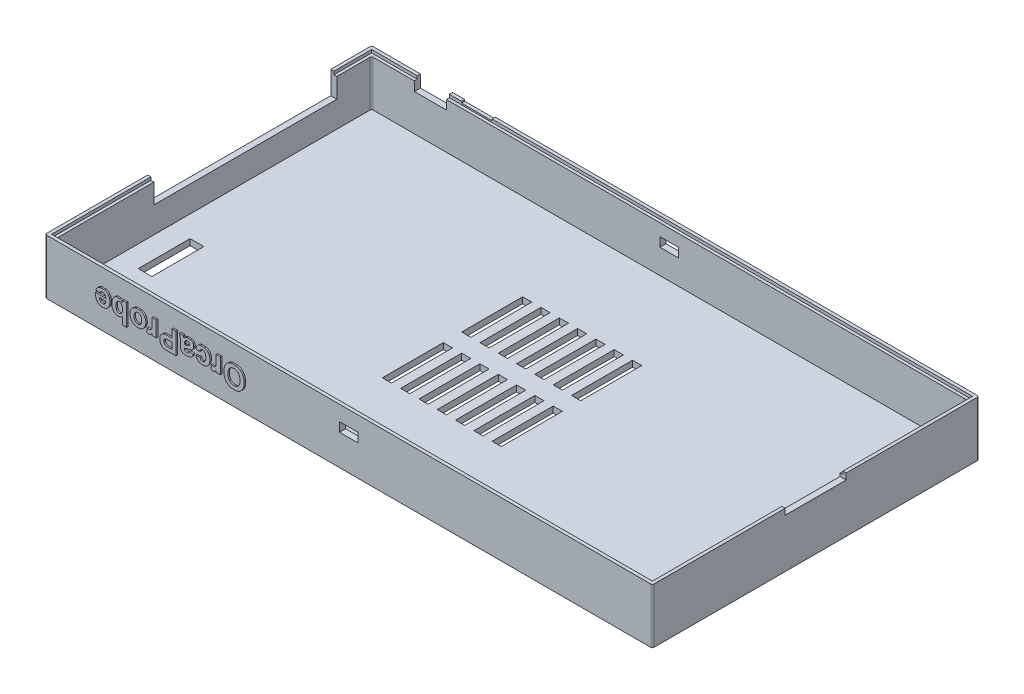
SolidWorks part; units mm, degrees
ref_plane "Front Plane" through (0, 0, 0) normal (0, 0, 1) x (1, 0, 0)
ref_plane "Top Plane" through (0, 0, 0) normal (0, 1, 0) x (1, 0, 0)
ref_plane "Right Plane" through (0, 0, 0) normal (1, 0, 0) x (0, 0, -1)
sketch "Sketch1" plane through (0, 0, 0) normal (0, 1, 0) x (1, 0, 0)
  line L1 (-97.5, 51.5) -> (97.5, 51.5)
  line L2 (-97.5, 51.5) -> (-97.5, -51.5)
  line L3 (-97.5, -51.5) -> (97.5, -51.5)
  line L4 (97.5, 51.5) -> (97.5, -51.5)
  line L5 (-97.5, 51.5) -> (97.5, -51.5) construction
  line L6 (-97.5, -51.5) -> (97.5, 51.5) construction
  point P0 (0, 0)
  dimension "D1" = 103
  dimension "D2" = 195
extrude "Boss-Extrude1" add sketch "Sketch1" along normal blind 2
sketch "Sketch2" plane through (0, 0, 0) normal (0, -1, 0) x (1, 0, 0)
  line L0 (99.5, -53.5) -> (99.5, 53.5)
  line L1 (99.5, 53.5) -> (-99.5, 53.5)
  line L2 (-99.5, 53.5) -> (-99.5, -53.5)
  line L3 (-99.5, -53.5) -> (99.5, -53.5)
  line L4 (97.5, -51.5) -> (97.5, 51.5)
  line L5 (97.5, 51.5) -> (-97.5, 51.5)
  line L6 (-97.5, 51.5) -> (-97.5, -51.5)
  line L7 (-97.5, -51.5) -> (97.5, -51.5)
  line L8 (97.5, -51.5) -> (97.5, 51.5)
  line L9 (97.5, 51.5) -> (-97.5, 51.5)
  line L10 (-97.5, 51.5) -> (-97.5, -51.5)
  line L11 (-97.5, -51.5) -> (97.5, -51.5)
  dimension "D1" = 0
  dimension "D2" = 2
extrude "Boss-Extrude2" add sketch "Sketch2" against normal blind 18
sketch "Sketch5" plane through (0, 18, 0) normal (0, 1, 0) x (1, 0, 0)
  line L0 (99.5, 53.5) -> (-99.5, 53.5) construction
  line L1 (-99.5, 53.5) -> (-99.5, -53.5) construction
  line L2 (-99.5, -53.5) -> (99.5, -53.5) construction
  line L3 (99.5, -53.5) -> (99.5, 53.5) construction
  line L4 (97.5, -51.5) -> (97.5, 51.5) construction
  line L5 (97.5, 51.5) -> (-97.5, 51.5) construction
  line L6 (-97.5, 51.5) -> (-97.5, -51.5) construction
  line L7 (-97.5, -51.5) -> (97.5, -51.5) construction
  line L8 (99.5, 53.5) -> (-99.5, 53.5)
  line L9 (-99.5, 53.5) -> (-99.5, -53.5)
  line L10 (-99.5, -53.5) -> (99.5, -53.5)
  line L11 (99.5, -53.5) -> (99.5, 53.5)
  line L12 (97.5, -51.5) -> (97.5, 51.5)
  line L13 (97.5, 51.5) -> (-97.5, 51.5)
  line L14 (-97.5, 51.5) -> (-97.5, -51.5)
  line L15 (-97.5, -51.5) -> (97.5, -51.5)
  line L16 (98.45, 52.45) -> (-98.45, 52.45)
  line L17 (-98.45, 52.45) -> (-98.45, -52.45)
  line L18 (-98.45, -52.45) -> (98.45, -52.45)
  line L19 (98.45, -52.45) -> (98.45, 52.45)
  dimension "D1" = 0.95
extrude "Cut-Extrude2" cut sketch "Sketch5" against normal blind 1 contours L18 L19 L16 L17 M8 M5 M6 M7
sketch "Sketch7" plane through (0, 0, -51.5) normal (0, 0, 1) x (1, 0, 0)
  line L0 (0, 17) -> (0, 2) construction
  line L2 (-3.05, 13.05) -> (3.05, 13.05)
  line L3 (-3.05, 13.05) -> (-3.05, 10.05)
  line L4 (97.5, 17) -> (-97.5, 17)
  line L5 (-97.5, 17) -> (-97.5, 2)
  line L6 (-97.5, 2) -> (97.5, 2)
  line L7 (97.5, 2) -> (97.5, 17)
  line L8 (97.5, 17) -> (-97.5, 17)
  line L9 (-97.5, 17) -> (-97.5, 2)
  line L10 (-97.5, 2) -> (97.5, 2)
  line L11 (97.5, 2) -> (97.5, 17)
  line L12 (-3.05, 10.05) -> (3.05, 10.05)
  line L13 (3.05, 13.05) -> (3.05, 10.05)
  line L14 (-3.05, 13.05) -> (3.05, 10.05) construction
  line L15 (-3.05, 10.05) -> (3.05, 13.05) construction
  point P6 (0, 11.55)
  dimension "D2" = 3.95
  dimension "D3" = 6.1
  dimension "D4" = 3
  dimension "D1" = 0
extrude "Cut-Extrude3" cut sketch "Sketch7" against normal through all both and the other way through all contours L3 L2 L13 L12
sketch "Sketch8" plane through (0, 0, 53.5) normal (0, 0, 1) x (1, 0, 0)
  line L0 (-33.3286, 12.4183) -> (-84.1269, 12.4183) construction
  line L1 (-42.9312, 12.4183) -> (-41.585, 12.4183)
  line L2 (-41.585, 12.4183) -> (-41.585, 7.303)
  line L3 (-41.585, 7.303) -> (-42.9312, 7.303)
  line L4 (-99.5, 0) -> (99.5, 0)
  line L5 (99.5, 0) -> (99.5, 18)
  line L6 (99.5, 18) -> (-99.5, 18)
  line L7 (-99.5, 18) -> (-99.5, 0)
  line L8 (-99.5, 0) -> (99.5, 0)
  line L9 (99.5, 0) -> (99.5, 18)
  line L10 (99.5, 18) -> (-99.5, 18)
  line L11 (-99.5, 18) -> (-99.5, 0)
  line L12 (-42.9312, 7.303) -> (-42.9312, 8.0167)
  line L13 (-44.7261, 7.4965) -> (-44.412, 8.7767)
  line L14 (-42.9312, 10.9011) -> (-42.9312, 12.4183)
  line L15 (-49.5722, 8.8286) -> (-48.2261, 9.0081)
  line L16 (-48.3158, 10.5337) -> (-49.662, 10.7132)
  line L17 (-51.6363, 8.8286) -> (-50.4697, 8.6491)
  line L18 (-54.6876, 9.1736) -> (-54.6876, 10.7455)
  line L19 (-55.0466, 12.4183) -> (-53.7004, 12.4183)
  line L20 (-53.3415, 9.0081) -> (-53.3415, 8.8805)
  line L21 (-53.3415, 10.2491) -> (-53.3415, 9.9953)
  line L22 (-56.1235, 12.4183) -> (-56.1235, 5.4183)
  line L23 (-56.1235, 5.4183) -> (-58.3629, 5.4183)
  line L24 (-58.3909, 9.8158) -> (-57.4697, 9.8158)
  line L25 (-57.4697, 9.8158) -> (-57.4697, 12.4183)
  line L26 (-57.4697, 12.4183) -> (-56.1235, 12.4183)
  line L27 (-57.4697, 6.585) -> (-57.4697, 8.6491)
  line L28 (-57.4697, 8.6491) -> (-58.2774, 8.6491)
  line L29 (-58.182, 6.585) -> (-57.4697, 6.585)
  line L30 (-63.9312, 12.4183) -> (-62.585, 12.4183)
  line L31 (-62.585, 12.4183) -> (-62.585, 7.303)
  line L32 (-62.585, 7.303) -> (-63.9312, 7.303)
  line L33 (-63.9312, 7.303) -> (-63.9312, 8.0167)
  line L34 (-65.7261, 7.4965) -> (-65.412, 8.7767)
  line L35 (-63.9312, 10.9011) -> (-63.9312, 12.4183)
  line L36 (-72.2774, 12.4183) -> (-72.2774, 5.4183)
  line L37 (-72.2774, 5.4183) -> (-73.6235, 5.4183)
  line L38 (-73.6235, 5.4183) -> (-73.6235, 7.9129)
  line L39 (-73.6235, 11.6794) -> (-73.6235, 12.4183)
  line L40 (-73.6235, 12.4183) -> (-72.2774, 12.4183)
  line L41 (-81.0722, 10.803) -> (-82.4184, 10.9825)
  line L42 (-82.5081, 10.2645) -> (-79.0979, 10.2645)
  line L43 (-79.1217, 9.4568) -> (-81.162, 9.4568)
  spline S0 degree 3 poles (-33.7774, 8.9604) (-33.7753, 8.7905) (-33.7874, 8.5409) (-33.8179, 8.2159) (-33.8541, 7.9883) (-33.8967, 7.7709) (-33.9662, 7.4994) (-34.0373, 7.3054) (-34.0901, 7.181) knots 0 0 0 0 0.280099 0.411798 0.538154 0.660002 0.777042 1 1 1 1
  spline S1 degree 3 poles (-34.0901, 7.181) (-34.1666, 7.0052) (-34.3063, 6.7521) (-34.5342, 6.4421) (-34.724, 6.2257) (-34.9288, 6.0295) (-35.2158, 5.8058) (-35.4496, 5.6712) (-35.6129, 5.6034) knots 0 0 0 0 0.256308 0.385121 0.514056 0.640986 0.763938 1 1 1 1
  spline S2 degree 3 poles (-35.6129, 5.6034) (-35.7213, 5.5572) (-35.889, 5.4951) (-36.1215, 5.4354) (-36.3026, 5.3948) (-36.4907, 5.3668) (-36.7524, 5.335) (-36.9529, 5.3293) (-37.0881, 5.3286) knots 0 0 0 0 0.23411 0.354106 0.476628 0.602521 0.731466 1 1 1 1
  spline S3 degree 3 poles (-37.0881, 5.3286) (-37.3287, 5.3304) (-37.6833, 5.3544) (-38.1366, 5.455) (-38.4495, 5.5614) (-38.745, 5.6944) (-39.0209, 5.8594) (-39.2777, 6.0546) (-39.5146, 6.2774) (-39.7285, 6.5266) (-39.9121, 6.8026) (-40.0709, 7.0997) (-40.1976, 7.4215) (-40.298, 7.7654) (-40.3915, 8.2682) (-40.4201, 8.6602) (-40.4184, 8.9282) knots 0 0 0 0 0.130227 0.191372 0.250609 0.308646 0.36635 0.42409 0.482748 0.54192 0.601306 0.661694 0.723753 0.787994 0.855173 1 1 1 1
  spline S4 degree 3 poles (-40.4184, 8.9282) (-40.4186, 9.194) (-40.3936, 9.5836) (-40.2991, 10.083) (-40.199, 10.4244) (-40.0734, 10.7443) (-39.9163, 11.0396) (-39.7342, 11.3144) (-39.5211, 11.5621) (-39.2867, 11.7851) (-39.0305, 11.9781) (-38.7575, 12.144) (-38.4634, 12.2774) (-38.1507, 12.381) (-37.6998, 12.4826) (-37.3468, 12.5063) (-37.1077, 12.5081) knots 0 0 0 0 0.144611 0.211674 0.276037 0.337883 0.398273 0.457645 0.516795 0.575603 0.633316 0.690913 0.749049 0.808543 0.869789 1 1 1 1
  spline S5 degree 3 poles (-37.1077, 12.5081) (-36.8654, 12.5058) (-36.5079, 12.4834) (-36.0524, 12.3805) (-35.7366, 12.2796) (-35.4414, 12.1445) (-35.1652, 11.9821) (-34.9096, 11.7877) (-34.6746, 11.5664) (-34.4616, 11.32) (-34.2798, 11.047) (-34.1223, 10.7543) (-33.997, 10.4375) (-33.8966, 10.0999) (-33.8024, 9.607) (-33.777, 9.2226) (-33.7774, 8.9604) knots 0 0 0 0 0.13222 0.194074 0.254079 0.312551 0.370559 0.428376 0.487115 0.546179 0.605446 0.665495 0.726979 0.790725 0.857159 1 1 1 1
  spline S6 degree 3 poles (-35.1235, 8.9141) (-35.1224, 9.1016) (-35.1391, 9.375) (-35.1973, 9.7251) (-35.2593, 9.9614) (-35.3371, 10.1804) (-35.4345, 10.3804) (-35.548, 10.5633) (-35.6807, 10.7255) (-35.8254, 10.8701) (-35.9793, 10.9971) (-36.1442, 11.1034) (-36.3181, 11.1906) (-36.5018, 11.2577) (-36.7621, 11.326) (-36.9671, 11.3397) (-37.1049, 11.3414) knots 0 0 0 0 0.159025 0.231845 0.300713 0.366067 0.428673 0.489076 0.548283 0.606046 0.662406 0.717184 0.77216 0.827113 0.882801 1 1 1 1
  spline S7 degree 3 poles (-37.1049, 11.3414) (-37.2428, 11.3403) (-37.4472, 11.3248) (-37.7081, 11.2594) (-37.891, 11.1926) (-38.0633, 11.104) (-38.2272, 10.9989) (-38.38, 10.8728) (-38.524, 10.7301) (-38.6531, 10.5669) (-38.7659, 10.3843) (-38.8618, 10.1827) (-38.9374, 9.9611) (-39.0005, 9.722) (-39.0554, 9.3649) (-39.074, 9.0863) (-39.0722, 8.8945) knots 0 0 0 0 0.116778 0.172169 0.226925 0.280998 0.335578 0.39118 0.448177 0.506677 0.566655 0.629221 0.694952 0.764337 0.838 1 1 1 1
  spline S8 degree 3 poles (-39.0722, 8.8945) (-39.0721, 8.7053) (-39.0583, 8.4299) (-39.0007, 8.0783) (-38.9425, 7.842) (-38.8666, 7.6252) (-38.7757, 7.4266) (-38.6661, 7.2476) (-38.5393, 7.0884) (-38.3982, 6.9492) (-38.2462, 6.8282) (-38.0835, 6.7244) (-37.9093, 6.6403) (-37.7234, 6.5753) (-37.4561, 6.5131) (-37.2467, 6.4955) (-37.1049, 6.4953) knots 0 0 0 0 0.161222 0.234273 0.303223 0.3682 0.429658 0.489001 0.54652 0.602548 0.657517 0.711752 0.766601 0.821882 0.879153 1 1 1 1
  spline S9 degree 3 poles (-37.1049, 6.4953) (-36.963, 6.4955) (-36.7537, 6.5132) (-36.4857, 6.5753) (-36.2993, 6.6414) (-36.125, 6.7278) (-35.9604, 6.8308) (-35.807, 6.9535) (-35.6653, 7.0954) (-35.5366, 7.2559) (-35.4255, 7.437) (-35.332, 7.6372) (-35.2542, 7.8558) (-35.197, 8.0939) (-35.136, 8.4469) (-35.1245, 8.7242) (-35.1235, 8.9141) knots 0 0 0 0 0.120039 0.176926 0.232342 0.286997 0.341204 0.396361 0.452852 0.510542 0.570032 0.63213 0.697177 0.76605 0.839067 1 1 1 1
  spline S10 degree 3 poles (-42.9312, 8.0167) (-42.9765, 7.9393) (-43.0398, 7.8266) (-43.1319, 7.6894) (-43.1967, 7.6021) (-43.2587, 7.5252) (-43.32, 7.46) (-43.3778, 7.4045) (-43.4551, 7.349) (-43.5535, 7.2946) (-43.7218, 7.2314) (-43.857, 7.2134) (-43.9478, 7.2132) knots 0 0 0 0 0.196067 0.282205 0.361076 0.433675 0.498005 0.556559 0.608461 0.705408 0.801424 1 1 1 1
  spline S11 degree 3 poles (-43.9478, 7.2132) (-44.083, 7.2132) (-44.3634, 7.2658) (-44.6096, 7.4092) (-44.7261, 7.4965) knots 0 0 0 0 0.480615 1 1 1 1
  spline S12 degree 3 poles (-44.412, 8.7767) (-44.3132, 8.7106) (-44.1183, 8.6057) (-43.9013, 8.5597) (-43.8006, 8.5594) knots 0 0 0 0 0.542857 1 1 1 1
  spline S13 degree 3 poles (-43.8006, 8.5594) (-43.7158, 8.5595) (-43.5903, 8.577) (-43.4372, 8.64) (-43.3347, 8.7077) (-43.242, 8.8007) (-43.1627, 8.9245) (-43.0936, 9.0773) (-43.0447, 9.2272) (-43.0124, 9.3724) (-42.9908, 9.5116) (-42.9711, 9.6775) (-42.9564, 9.8703) (-42.9456, 10.0901) (-42.9341, 10.4364) (-42.9304, 10.7099) (-42.9312, 10.9011) knots 0 0 0 0 0.091623 0.134828 0.177797 0.223473 0.27554 0.335599 0.404062 0.445443 0.496051 0.556017 0.62588 0.704708 0.793577 1 1 1 1
  spline S14 degree 3 poles (-48.2261, 9.0081) (-48.2048, 8.8883) (-48.163, 8.7139) (-48.0482, 8.5173) (-47.9474, 8.4001) (-47.8256, 8.3115) (-47.6378, 8.2201) (-47.4769, 8.201) (-47.3693, 8.2004) knots 0 0 0 0 0.282192 0.405789 0.521816 0.635786 0.750455 1 1 1 1
  spline S15 degree 3 poles (-47.3693, 8.2004) (-47.2947, 8.201) (-47.1836, 8.2092) (-47.0442, 8.2506) (-46.9459, 8.2892) (-46.8553, 8.3419) (-46.7694, 8.4041) (-46.6911, 8.4793) (-46.6177, 8.5652) (-46.5502, 8.6644) (-46.4955, 8.7804) (-46.4472, 8.9107) (-46.409, 9.0564) (-46.3783, 9.2171) (-46.3471, 9.4609) (-46.3421, 9.6526) (-46.3415, 9.7849) knots 0 0 0 0 0.105025 0.154878 0.203749 0.252836 0.301667 0.352271 0.404877 0.460213 0.520091 0.584461 0.655147 0.731346 0.814052 1 1 1 1
  spline S16 degree 3 poles (-46.3415, 9.7849) (-46.3407, 9.9319) (-46.349, 10.1443) (-46.3797, 10.4148) (-46.4095, 10.5922) (-46.4505, 10.7515) (-46.4988, 10.8942) (-46.5572, 11.0196) (-46.6257, 11.1276) (-46.7005, 11.2212) (-46.7821, 11.3015) (-46.8695, 11.3696) (-46.9634, 11.4248) (-47.0631, 11.4685) (-47.2074, 11.5107) (-47.3216, 11.5213) (-47.3988, 11.5209) knots 0 0 0 0 0.192168 0.2777 0.355889 0.427205 0.492549 0.552708 0.607657 0.659402 0.709113 0.757045 0.803908 0.851267 0.899047 1 1 1 1
  spline S17 degree 3 poles (-47.3988, 11.5209) (-47.5102, 11.522) (-47.6747, 11.4953) (-47.8706, 11.4009) (-47.9746, 11.318) (-48.0473, 11.2369) (-48.1001, 11.167) (-48.1447, 11.0846) (-48.1898, 10.9948) (-48.226, 10.893) (-48.2758, 10.7405) (-48.2988, 10.6176) (-48.3158, 10.5337) knots 0 0 0 0 0.224156 0.328867 0.434599 0.489185 0.547672 0.610419 0.677286 0.749591 0.827505 1 1 1 1
  spline S18 degree 3 poles (-49.662, 10.7132) (-49.6296, 10.8544) (-49.5704, 11.0593) (-49.4636, 11.317) (-49.3725, 11.4917) (-49.271, 11.6536) (-49.1574, 11.8011) (-49.0316, 11.9349) (-48.8954, 12.0566) (-48.7459, 12.163) (-48.5854, 12.2568) (-48.4116, 12.3328) (-48.2274, 12.3986) (-48.0298, 12.4463) (-47.7446, 12.4971) (-47.5219, 12.5074) (-47.3707, 12.5081) knots 0 0 0 0 0.136031 0.199773 0.261611 0.32079 0.378994 0.436129 0.493026 0.550273 0.608089 0.667225 0.728164 0.791502 0.857887 1 1 1 1
  spline S19 degree 3 poles (-47.3707, 12.5081) (-47.1985, 12.5074) (-46.9445, 12.489) (-46.6199, 12.4145) (-46.3952, 12.3375) (-46.1841, 12.2389) (-45.9878, 12.1171) (-45.805, 11.9734) (-45.6365, 11.8091) (-45.4849, 11.6257) (-45.354, 11.4235) (-45.243, 11.2048) (-45.1514, 10.9696) (-45.0817, 10.7167) (-45.0136, 10.3484) (-44.9944, 10.0609) (-44.9953, 9.8649) knots 0 0 0 0 0.128618 0.18913 0.248159 0.305594 0.362622 0.420272 0.478745 0.53798 0.597494 0.658191 0.720713 0.785555 0.853709 1 1 1 1
  spline S20 degree 3 poles (-44.9953, 9.8649) (-44.9944, 9.667) (-45.0134, 9.3771) (-45.0816, 9.0059) (-45.1518, 8.752) (-45.2413, 8.5148) (-45.3524, 8.2954) (-45.4835, 8.0928) (-45.6352, 7.9095) (-45.8033, 7.7451) (-45.9866, 7.6024) (-46.1846, 7.4826) (-46.3962, 7.3841) (-46.6221, 7.3063) (-46.9498, 7.2326) (-47.2064, 7.2138) (-47.3805, 7.2132) knots 0 0 0 0 0.146966 0.215132 0.279994 0.342413 0.403126 0.462352 0.521299 0.579489 0.636646 0.693512 0.750984 0.809727 0.870622 1 1 1 1
  spline S21 degree 3 poles (-47.3805, 7.2132) (-47.5231, 7.2113) (-47.7316, 7.2253) (-48.0004, 7.2661) (-48.1855, 7.31) (-48.3594, 7.3653) (-48.5213, 7.4348) (-48.6729, 7.5143) (-48.8122, 7.6089) (-48.9405, 7.7168) (-49.0607, 7.8361) (-49.1698, 7.9701) (-49.2698, 8.1164) (-49.3592, 8.276) (-49.4711, 8.51) (-49.534, 8.6989) (-49.5722, 8.8286) knots 0 0 0 0 0.143786 0.21066 0.274183 0.335664 0.394651 0.451859 0.508267 0.564214 0.620937 0.67894 0.73836 0.799641 0.863384 1 1 1 1
  spline S22 degree 3 poles (-50.4697, 8.6491) (-50.5026, 8.5332) (-50.5574, 8.364) (-50.6577, 8.155) (-50.7388, 8.0124) (-50.83, 7.882) (-50.9298, 7.7635) (-51.0387, 7.6573) (-51.1574, 7.5626) (-51.288, 7.4785) (-51.4335, 7.4072) (-51.5938, 7.3471) (-51.7686, 7.2989) (-51.9575, 7.2586) (-52.2392, 7.2243) (-52.4586, 7.2124) (-52.6095, 7.2132) knots 0 0 0 0 0.12811 0.188034 0.245824 0.302124 0.356698 0.410033 0.463348 0.517578 0.574607 0.635063 0.698994 0.76692 0.839974 1 1 1 1
  spline S23 degree 3 poles (-52.6095, 7.2132) (-52.7462, 7.2104) (-52.944, 7.2215) (-53.1981, 7.2399) (-53.3676, 7.2654) (-53.5242, 7.2925) (-53.6658, 7.332) (-53.795, 7.3721) (-53.9429, 7.4396) (-54.1065, 7.5326) (-54.275, 7.6616) (-54.4126, 7.8052) (-54.5036, 7.9397) (-54.5579, 8.0624) (-54.5919, 8.1713) (-54.6234, 8.296) (-54.6456, 8.4388) (-54.6661, 8.5982) (-54.6816, 8.8452) (-54.6884, 9.0388) (-54.6876, 9.1736) knots 0 0 0 0 0.121261 0.175808 0.226098 0.27338 0.31676 0.356518 0.393298 0.46077 0.523183 0.581002 0.636703 0.666236 0.699828 0.737868 0.780366 0.828024 0.880439 1 1 1 1
  spline S24 degree 3 poles (-54.6876, 10.7455) (-54.6896, 10.8501) (-54.6871, 11.0018) (-54.6992, 11.196) (-54.7042, 11.3253) (-54.7167, 11.4434) (-54.7283, 11.5507) (-54.7438, 11.6471) (-54.7683, 11.7623) (-54.8085, 11.9016) (-54.8941, 12.1337) (-54.9827, 12.3035) (-55.0466, 12.4183) knots 0 0 0 0 0.180907 0.261761 0.336164 0.404304 0.466908 0.522535 0.572901 0.670292 0.772747 1 1 1 1
  spline S25 degree 3 poles (-53.7004, 12.4183) (-53.6781, 12.3595) (-53.6363, 12.2162) (-53.5946, 12.0729) (-53.5728, 11.9893) knots 0 0 0 0 0.42099 1 1 1 1
  spline S26 degree 3 poles (-53.5728, 11.9893) (-53.5658, 11.953) (-53.5452, 11.8977) (-53.5333, 11.84) (-53.5252, 11.8196) knots 0 0 0 0 0.627226 1 1 1 1
  spline S27 degree 3 poles (-53.5252, 11.8196) (-53.4154, 11.9287) (-53.2431, 12.0808) (-52.9888, 12.2405) (-52.7968, 12.3387) (-52.5982, 12.4152) (-52.322, 12.4863) (-52.108, 12.508) (-51.9645, 12.5081) knots 0 0 0 0 0.265204 0.391032 0.513017 0.63379 0.754465 1 1 1 1
  spline S28 degree 3 poles (-51.9645, 12.5081) (-51.8414, 12.5062) (-51.6598, 12.4985) (-51.4292, 12.4486) (-51.2691, 12.4038) (-51.1206, 12.3414) (-50.9817, 12.2667) (-50.8533, 12.1783) (-50.7376, 12.0753) (-50.6325, 11.9639) (-50.5409, 11.8441) (-50.4628, 11.717) (-50.4002, 11.5821) (-50.3502, 11.4404) (-50.3034, 11.2388) (-50.2899, 11.0816) (-50.2902, 10.9754) knots 0 0 0 0 0.144841 0.212128 0.276749 0.339751 0.40091 0.461666 0.522344 0.582539 0.641279 0.699178 0.757379 0.815538 0.875322 1 1 1 1
  spline S29 degree 3 poles (-50.2902, 10.9754) (-50.2915, 10.8362) (-50.3113, 10.6283) (-50.3981, 10.3689) (-50.4846, 10.1902) (-50.5944, 10.0284) (-50.7247, 9.8847) (-50.8764, 9.7621) (-51.0511, 9.6571) (-51.2559, 9.5694) (-51.5972, 9.451) (-51.8793, 9.3868) (-52.0794, 9.3446) knots 0 0 0 0 0.156294 0.231277 0.305251 0.377986 0.449497 0.521682 0.595651 0.676965 0.770661 1 1 1 1
  spline S30 degree 3 poles (-52.0794, 9.3446) (-52.2198, 9.3157) (-52.4221, 9.2757) (-52.678, 9.2146) (-52.8447, 9.1728) (-52.9937, 9.1308) (-53.1593, 9.0808) (-53.2725, 9.0376) (-53.3415, 9.0081) knots 0 0 0 0 0.32859 0.472888 0.603397 0.722514 0.827959 1 1 1 1
  spline S31 degree 3 poles (-53.3415, 8.8805) (-53.3408, 8.7753) (-53.3276, 8.6216) (-53.2459, 8.4478) (-53.1776, 8.3658) (-53.109, 8.3174) (-53.0481, 8.2846) (-52.9766, 8.2589) (-52.8953, 8.2379) (-52.8043, 8.2216) (-52.6634, 8.2036) (-52.552, 8.2015) (-52.4749, 8.2004) knots 0 0 0 0 0.247438 0.350285 0.443787 0.492182 0.545326 0.604638 0.668872 0.740907 0.819984 1 1 1 1
  spline S32 degree 3 poles (-52.4749, 8.2004) (-52.3734, 8.2004) (-52.2268, 8.2127) (-52.0511, 8.2745) (-51.9415, 8.3357) (-51.8474, 8.4224) (-51.7323, 8.5817) (-51.671, 8.7253) (-51.6363, 8.8286) knots 0 0 0 0 0.267293 0.38058 0.486623 0.594299 0.713526 1 1 1 1
  spline S33 degree 3 poles (-53.3415, 9.9953) (-53.2377, 10.0283) (-53.0639, 10.0775) (-52.8067, 10.1389) (-52.6128, 10.1816) (-52.4503, 10.217) (-52.3356, 10.2447) (-52.2324, 10.2731) (-52.1405, 10.3004) (-52.0597, 10.3288) (-51.9737, 10.3631) (-51.9152, 10.3903) (-51.8831, 10.4131) knots 0 0 0 0 0.214763 0.356061 0.52133 0.606314 0.684116 0.753886 0.817455 0.873137 0.922777 1 1 1 1
  spline S34 degree 3 poles (-51.8831, 10.4131) (-51.8085, 10.4654) (-51.6797, 10.597) (-51.635, 10.7757) (-51.6363, 10.8619) knots 0 0 0 0 0.515778 1 1 1 1
  spline S35 degree 3 poles (-51.6363, 10.8619) (-51.6367, 10.9473) (-51.6594, 11.0766) (-51.7451, 11.2282) (-51.8317, 11.329) (-51.9358, 11.4155) (-52.1027, 11.4989) (-52.2437, 11.5209) (-52.3389, 11.5209) knots 0 0 0 0 0.239489 0.357648 0.482798 0.609122 0.733594 1 1 1 1
  spline S36 degree 3 poles (-52.3389, 11.5209) (-52.4521, 11.5208) (-52.6867, 11.4819) (-52.8935, 11.3647) (-52.9909, 11.2938) knots 0 0 0 0 0.483779 1 1 1 1
  spline S37 degree 3 poles (-52.9909, 11.2938) (-53.0642, 11.2407) (-53.1882, 11.1131) (-53.2697, 10.9547) (-53.2924, 10.8717) knots 0 0 0 0 0.513014 1 1 1 1
  spline S38 degree 3 poles (-53.2924, 10.8717) (-53.313, 10.7941) (-53.3375, 10.5864) (-53.3419, 10.3777) (-53.3415, 10.2491) knots 0 0 0 0 0.38346 1 1 1 1
  spline S39 degree 3 poles (-58.3629, 5.4183) (-58.5564, 5.4175) (-58.8332, 5.4212) (-59.1837, 5.4329) (-59.4054, 5.4433) (-59.599, 5.4587) (-59.8027, 5.4808) (-59.9414, 5.5023) (-60.0232, 5.5249) knots 0 0 0 0 0.34833 0.498164 0.631258 0.747724 0.847597 1 1 1 1
  spline S40 degree 3 poles (-60.0232, 5.5249) (-60.1212, 5.5495) (-60.2632, 5.6023) (-60.4427, 5.6941) (-60.5696, 5.7758) (-60.6917, 5.8674) (-60.8064, 5.9718) (-60.9165, 6.0873) (-61.0194, 6.2141) (-61.1144, 6.3515) (-61.195, 6.5005) (-61.2645, 6.6584) (-61.3199, 6.8262) (-61.3657, 7.0031) (-61.4059, 7.2585) (-61.4204, 7.4558) (-61.4184, 7.5904) knots 0 0 0 0 0.112518 0.168209 0.224432 0.280596 0.338142 0.397105 0.458213 0.520063 0.583016 0.646708 0.712116 0.779846 0.850081 1 1 1 1
  spline S41 degree 3 poles (-61.4184, 7.5904) (-61.4205, 7.7914) (-61.3931, 8.083) (-61.2946, 8.4475) (-61.1902, 8.6832) (-61.0656, 8.8941) (-60.9223, 9.08) (-60.7671, 9.2454) (-60.5934, 9.3816) (-60.4125, 9.4954) (-60.1739, 9.6225) (-59.9844, 9.6861) (-59.8577, 9.7148) knots 0 0 0 0 0.210528 0.305147 0.394439 0.479889 0.561317 0.639975 0.717023 0.791911 0.863787 1 1 1 1
  spline S42 degree 3 poles (-59.8577, 9.7148) (-59.7643, 9.7332) (-59.6169, 9.7567) (-59.4096, 9.7776) (-59.2334, 9.7915) (-59.0426, 9.8025) (-58.7603, 9.8145) (-58.5414, 9.8152) (-58.3909, 9.8158) knots 0 0 0 0 0.193876 0.303997 0.424377 0.554128 0.693296 1 1 1 1
  spline S43 degree 3 poles (-58.2774, 8.6491) (-58.4106, 8.6491) (-58.602, 8.6478) (-58.8444, 8.6326) (-58.9999, 8.6232) (-59.1364, 8.6058) (-59.2554, 8.5869) (-59.3562, 8.5635) (-59.4655, 8.5287) (-59.583, 8.4736) (-59.7081, 8.3918) (-59.817, 8.2929) (-59.9083, 8.1786) (-59.9819, 8.0522) (-60.0525, 7.8648) (-60.0739, 7.7139) (-60.0722, 7.6115) knots 0 0 0 0 0.168841 0.242402 0.307726 0.366205 0.416644 0.460461 0.497174 0.561832 0.624256 0.685892 0.747405 0.808969 0.870459 1 1 1 1
  spline S44 degree 3 poles (-60.0722, 7.6115) (-60.0744, 7.4886) (-60.0456, 7.3078) (-59.9458, 7.091) (-59.8419, 6.9534) (-59.7168, 6.8372) (-59.525, 6.7099) (-59.3588, 6.6554) (-59.2449, 6.6341) knots 0 0 0 0 0.263219 0.386149 0.508701 0.630747 0.750909 1 1 1 1
  spline S45 degree 3 poles (-59.2449, 6.6341) (-59.1901, 6.6244) (-59.0989, 6.614) (-58.9659, 6.6039) (-58.8411, 6.597) (-58.6999, 6.5916) (-58.4784, 6.5851) (-58.304, 6.5871) (-58.182, 6.585) knots 0 0 0 0 0.156655 0.258348 0.375719 0.50881 0.656332 1 1 1 1
  spline S46 degree 3 poles (-63.9312, 8.0167) (-63.9765, 7.9393) (-64.0398, 7.8266) (-64.1319, 7.6894) (-64.1967, 7.6021) (-64.2587, 7.5252) (-64.32, 7.46) (-64.3778, 7.4045) (-64.4551, 7.349) (-64.5535, 7.2946) (-64.7218, 7.2314) (-64.857, 7.2134) (-64.9478, 7.2132) knots 0 0 0 0 0.196067 0.282205 0.361076 0.433675 0.498005 0.556559 0.608461 0.705408 0.801424 1 1 1 1
  spline S47 degree 3 poles (-64.9478, 7.2132) (-65.083, 7.2132) (-65.3634, 7.2658) (-65.6096, 7.4092) (-65.7261, 7.4965) knots 0 0 0 0 0.480615 1 1 1 1
  spline S48 degree 3 poles (-65.412, 8.7767) (-65.3132, 8.7106) (-65.1183, 8.6057) (-64.9013, 8.5597) (-64.8006, 8.5594) knots 0 0 0 0 0.542857 1 1 1 1
  spline S49 degree 3 poles (-64.8006, 8.5594) (-64.7158, 8.5595) (-64.5903, 8.577) (-64.4372, 8.64) (-64.3347, 8.7077) (-64.242, 8.8007) (-64.1627, 8.9245) (-64.0936, 9.0773) (-64.0447, 9.2272) (-64.0124, 9.3724) (-63.9908, 9.5116) (-63.9711, 9.6775) (-63.9564, 9.8703) (-63.9456, 10.0901) (-63.9341, 10.4364) (-63.9304, 10.7099) (-63.9312, 10.9011) knots 0 0 0 0 0.091623 0.134828 0.177797 0.223473 0.27554 0.335599 0.404062 0.445443 0.496051 0.556017 0.62588 0.704708 0.793577 1 1 1 1
  spline S50 degree 3 poles (-65.9953, 9.7891) (-65.9972, 9.5685) (-66.0351, 9.2341) (-66.1758, 8.8067) (-66.2939, 8.5457) (-66.4066, 8.3442) (-66.5023, 8.2019) (-66.6044, 8.0672) (-66.7176, 7.944) (-66.8378, 7.8285) (-66.9678, 7.7233) (-67.1051, 7.6261) (-67.2512, 7.5394) (-67.4031, 7.4627) (-67.5604, 7.3969) (-67.7207, 7.3382) (-67.8874, 7.2948) (-68.0573, 7.2569) (-68.293, 7.2243) (-68.4728, 7.2133) (-68.5937, 7.2132) knots 0 0 0 0 0.161817 0.244248 0.328865 0.37135 0.41334 0.454377 0.495112 0.535814 0.57647 0.617523 0.658995 0.700813 0.742101 0.78392 0.825797 0.868189 0.911445 1 1 1 1
  spline S51 degree 3 poles (-68.5937, 7.2132) (-68.7767, 7.213) (-69.0473, 7.2335) (-69.3931, 7.3137) (-69.6353, 7.3953) (-69.8644, 7.5011) (-70.0818, 7.6288) (-70.2848, 7.7818) (-70.4731, 7.9562) (-70.6428, 8.1489) (-70.7932, 8.3542) (-70.918, 8.5736) (-71.0229, 8.804) (-71.1028, 9.0477) (-71.178, 9.3945) (-71.2019, 9.6638) (-71.2004, 9.8466) knots 0 0 0 0 0.13227 0.195 0.255961 0.316536 0.376926 0.437695 0.499809 0.561994 0.622905 0.683247 0.74399 0.805484 0.868065 1 1 1 1
  spline S52 degree 3 poles (-71.2004, 9.8466) (-71.2017, 10.0308) (-71.1786, 10.3026) (-71.1015, 10.6527) (-71.0196, 10.898) (-70.9172, 11.1323) (-70.7885, 11.3526) (-70.6378, 11.5611) (-70.466, 11.7553) (-70.276, 11.931) (-70.0729, 12.0863) (-69.8563, 12.2156) (-69.6295, 12.3234) (-69.3896, 12.4064) (-69.0481, 12.4853) (-68.7822, 12.5101) (-68.6021, 12.5081) knots 0 0 0 0 0.132653 0.195828 0.257933 0.318712 0.379842 0.441363 0.503887 0.566341 0.627651 0.687791 0.747766 0.808384 0.87032 1 1 1 1
  spline S53 degree 3 poles (-68.6021, 12.5081) (-68.3745, 12.5077) (-68.0321, 12.4703) (-67.5943, 12.3352) (-67.3298, 12.2213) (-67.1268, 12.1124) (-66.9831, 12.0198) (-66.8504, 11.9164) (-66.7237, 11.8075) (-66.6095, 11.6863) (-66.5033, 11.557) (-66.4084, 11.4173) (-66.3212, 11.2701) (-66.2436, 11.1143) (-66.1784, 10.9491) (-66.1202, 10.7768) (-66.0741, 10.5954) (-66.0395, 10.4056) (-66.0053, 10.1365) (-65.9958, 9.9296) (-65.9953, 9.7891) knots 0 0 0 0 0.16055 0.24084 0.322341 0.363196 0.403243 0.442735 0.481744 0.520913 0.560039 0.599629 0.639823 0.680657 0.722219 0.764956 0.808848 0.854104 0.900959 1 1 1 1
  spline S54 degree 3 poles (-67.3415, 9.8607) (-67.3413, 9.9872) (-67.3516, 10.172) (-67.3886, 10.4091) (-67.4299, 10.5691) (-67.4799, 10.7185) (-67.5433, 10.8552) (-67.6157, 10.9819) (-67.702, 11.0937) (-67.7959, 11.1928) (-67.8944, 11.2808) (-67.9984, 11.3557) (-68.1085, 11.4166) (-68.2246, 11.4628) (-68.3873, 11.5087) (-68.5151, 11.5201) (-68.6007, 11.5209) knots 0 0 0 0 0.162283 0.237015 0.307558 0.374125 0.438795 0.500611 0.560943 0.619487 0.675564 0.73015 0.783564 0.836573 0.890118 1 1 1 1
  spline S55 degree 3 poles (-68.6007, 11.5209) (-68.6862, 11.5202) (-68.814, 11.5086) (-68.9764, 11.4631) (-69.0918, 11.4162) (-69.2016, 11.3557) (-69.3055, 11.2807) (-69.4039, 11.1931) (-69.4971, 11.0936) (-69.5808, 10.9802) (-69.654, 10.8539) (-69.7174, 10.7167) (-69.7676, 10.5665) (-69.8067, 10.4047) (-69.8446, 10.1655) (-69.8543, 9.9787) (-69.8543, 9.8508) knots 0 0 0 0 0.109603 0.163012 0.215332 0.26861 0.323057 0.378992 0.436979 0.497276 0.558935 0.623441 0.690405 0.761205 0.836338 1 1 1 1
  spline S56 degree 3 poles (-69.8543, 9.8508) (-69.8543, 9.7258) (-69.8447, 9.5432) (-69.8066, 9.3092) (-69.7674, 9.1502) (-69.7175, 9.0017) (-69.6536, 8.8657) (-69.5813, 8.7398) (-69.4966, 8.6276) (-69.404, 8.5281) (-69.3055, 8.4406) (-69.2016, 8.3656) (-69.0918, 8.3051) (-68.9764, 8.2582) (-68.814, 8.2127) (-68.6862, 8.2011) (-68.6007, 8.2004) knots 0 0 0 0 0.161389 0.23535 0.305557 0.372497 0.436983 0.499145 0.559452 0.617912 0.674304 0.729196 0.782909 0.835656 0.889501 1 1 1 1
  spline S57 degree 3 poles (-68.6007, 8.2004) (-68.5151, 8.2012) (-68.3873, 8.2126) (-68.2246, 8.2585) (-68.1085, 8.3047) (-67.9984, 8.3656) (-67.8944, 8.4406) (-67.7959, 8.5285) (-67.702, 8.6276) (-67.6157, 8.7394) (-67.5433, 8.8661) (-67.4799, 9.0028) (-67.4299, 9.1522) (-67.3886, 9.3122) (-67.3516, 9.5494) (-67.3413, 9.7341) (-67.3415, 9.8607) knots 0 0 0 0 0.109882 0.163427 0.216436 0.26985 0.324436 0.380513 0.439057 0.499389 0.561205 0.625875 0.692442 0.762985 0.837717 1 1 1 1
  spline S58 degree 3 poles (-73.6235, 7.9129) (-73.7192, 7.8024) (-73.8726, 7.6498) (-74.102, 7.4844) (-74.2784, 7.3861) (-74.4607, 7.3074) (-74.7161, 7.2341) (-74.9159, 7.2136) (-75.0496, 7.2132) knots 0 0 0 0 0.267281 0.393393 0.515773 0.635564 0.755599 1 1 1 1
  spline S59 degree 3 poles (-75.0496, 7.2132) (-75.1938, 7.2109) (-75.4065, 7.2339) (-75.6798, 7.3027) (-75.8711, 7.3783) (-76.0535, 7.4723) (-76.2255, 7.5888) (-76.3887, 7.7249) (-76.5401, 7.8824) (-76.6779, 8.0589) (-76.7974, 8.2553) (-76.8985, 8.4698) (-76.9811, 8.7024) (-77.0454, 8.9535) (-77.1085, 9.3228) (-77.1217, 9.6117) (-77.1235, 9.8088) knots 0 0 0 0 0.115439 0.170815 0.225536 0.280032 0.335141 0.39183 0.45016 0.510003 0.571085 0.63414 0.699834 0.768758 0.841794 1 1 1 1
  spline S60 degree 3 poles (-77.1235, 9.8088) (-77.1213, 10.0128) (-77.1092, 10.3117) (-77.0446, 10.6936) (-76.9833, 10.9542) (-76.8993, 11.1949) (-76.8007, 11.4185) (-76.6805, 11.6223) (-76.5451, 11.8078) (-76.3945, 11.9713) (-76.2363, 12.115) (-76.0699, 12.2372) (-75.8948, 12.3355) (-75.7128, 12.4139) (-75.4565, 12.4875) (-75.2557, 12.5075) (-75.1211, 12.5081) knots 0 0 0 0 0.162917 0.237757 0.308744 0.376188 0.440771 0.503436 0.56451 0.623624 0.68038 0.73482 0.78791 0.840195 0.892587 1 1 1 1
  spline S61 degree 3 poles (-75.1211, 12.5081) (-74.9839, 12.5075) (-74.7757, 12.4835) (-74.5087, 12.3951) (-74.3083, 12.3079) (-74.1143, 12.1939) (-73.8707, 11.9955) (-73.7141, 11.8139) (-73.6235, 11.6794) knots 0 0 0 0 0.231263 0.349517 0.472531 0.5989 0.727131 1 1 1 1
  spline S62 degree 3 poles (-73.6235, 9.7639) (-73.6241, 9.8911) (-73.6302, 10.0754) (-73.6553, 10.3113) (-73.68, 10.4688) (-73.7129, 10.6135) (-73.7681, 10.7815) (-73.8178, 10.8992) (-73.8619, 10.9684) knots 0 0 0 0 0.307439 0.444851 0.572938 0.692356 0.802694 1 1 1 1
  spline S63 degree 3 poles (-73.8619, 10.9684) (-73.9141, 11.0543) (-74.0013, 11.1739) (-74.1405, 11.306) (-74.2489, 11.3856) (-74.3648, 11.4466) (-74.5305, 11.5035) (-74.6618, 11.5221) (-74.7509, 11.5209) knots 0 0 0 0 0.274839 0.401266 0.52281 0.64101 0.757284 1 1 1 1
  spline S64 degree 3 poles (-74.7509, 11.5209) (-74.8198, 11.5218) (-74.9227, 11.5097) (-75.0535, 11.4684) (-75.1465, 11.4237) (-75.2369, 11.3697) (-75.3215, 11.3006) (-75.403, 11.2206) (-75.4803, 11.128) (-75.5507, 11.0221) (-75.6129, 10.9026) (-75.6625, 10.7679) (-75.7044, 10.6202) (-75.738, 10.4586) (-75.7704, 10.2151) (-75.7776, 10.0244) (-75.7774, 9.8929) knots 0 0 0 0 0.096058 0.14329 0.190846 0.239725 0.289837 0.342872 0.398903 0.45769 0.520112 0.586368 0.657588 0.734204 0.816477 1 1 1 1
  spline S65 degree 3 poles (-75.7774, 9.8929) (-75.7778, 9.7535) (-75.7704, 9.5516) (-75.7381, 9.2941) (-75.7044, 9.1241) (-75.6631, 8.969) (-75.6114, 8.8293) (-75.55, 8.7055) (-75.4793, 8.5972) (-75.3995, 8.5046) (-75.3163, 8.4228) (-75.2264, 8.3548) (-75.1323, 8.298) (-75.0319, 8.2541) (-74.8887, 8.213) (-74.7765, 8.1986) (-74.7004, 8.2004) knots 0 0 0 0 0.185433 0.268144 0.344806 0.415665 0.481347 0.542491 0.599027 0.652819 0.704681 0.753903 0.802397 0.850544 0.899118 1 1 1 1
  spline S66 degree 3 poles (-74.7004, 8.2004) (-74.6261, 8.1999) (-74.5152, 8.211) (-74.3749, 8.2531) (-74.2753, 8.2953) (-74.1813, 8.3509) (-74.0908, 8.4167) (-74.0064, 8.4961) (-73.9281, 8.5874) (-73.8556, 8.6906) (-73.7929, 8.8067) (-73.7411, 8.9364) (-73.6979, 9.0776) (-73.6643, 9.2314) (-73.6325, 9.4609) (-73.6218, 9.6402) (-73.6235, 9.7639) knots 0 0 0 0 0.104727 0.155516 0.205619 0.256621 0.30886 0.362854 0.419298 0.477883 0.539996 0.604623 0.674128 0.747555 0.825987 1 1 1 1
  spline S67 degree 3 poles (-82.4184, 10.9825) (-82.3771, 11.1023) (-82.3058, 11.2762) (-82.185, 11.4912) (-82.0892, 11.6404) (-81.9819, 11.7773) (-81.8646, 11.902) (-81.7404, 12.0181) (-81.6048, 12.1202) (-81.461, 12.2119) (-81.3086, 12.2924) (-81.1457, 12.3572) (-80.9764, 12.4147) (-80.7971, 12.4555) (-80.5426, 12.4984) (-80.3452, 12.5082) (-80.2113, 12.5081) knots 0 0 0 0 0.131627 0.19439 0.255749 0.31553 0.374569 0.433277 0.491785 0.550462 0.610134 0.670404 0.732229 0.795536 0.860934 1 1 1 1
  spline S68 degree 3 poles (-80.2113, 12.5081) (-80.0048, 12.5051) (-79.7008, 12.4881) (-79.319, 12.3914) (-79.0605, 12.2996) (-78.8259, 12.1748) (-78.5367, 11.9785) (-78.3586, 11.7833) (-78.2537, 11.6443) knots 0 0 0 0 0.27925 0.4072 0.530031 0.648157 0.764597 1 1 1 1
  spline S69 degree 3 poles (-78.2537, 11.6443) (-78.1693, 11.5285) (-78.058, 11.3421) (-77.9447, 11.0738) (-77.8729, 10.8613) (-77.8185, 10.6364) (-77.7648, 10.3158) (-77.7536, 10.067) (-77.7517, 9.8985) knots 0 0 0 0 0.232769 0.350792 0.472504 0.596786 0.726082 1 1 1 1
  spline S70 degree 3 poles (-77.7517, 9.8985) (-77.7514, 9.6993) (-77.7689, 9.4073) (-77.8393, 9.0333) (-77.9126, 8.7772) (-78.0043, 8.5374) (-78.1193, 8.3155) (-78.2535, 8.1097) (-78.4099, 7.9239) (-78.5803, 7.7569) (-78.7638, 7.6123) (-78.9561, 7.487) (-79.1616, 7.3877) (-79.3768, 7.3079) (-79.6847, 7.2352) (-79.9242, 7.2126) (-80.0865, 7.2132) knots 0 0 0 0 0.149253 0.218403 0.284677 0.348527 0.410383 0.471563 0.532217 0.591889 0.649961 0.706972 0.763501 0.820546 0.878547 1 1 1 1
  spline S71 degree 3 poles (-80.0865, 7.2132) (-80.2667, 7.2128) (-80.5322, 7.2334) (-80.8705, 7.3131) (-81.1034, 7.3967) (-81.3222, 7.5017) (-81.5257, 7.6316) (-81.7127, 7.7863) (-81.8869, 7.9613) (-82.0403, 8.1636) (-82.1721, 8.391) (-82.2831, 8.6426) (-82.3728, 8.9188) (-82.4391, 9.2204) (-82.5021, 9.6704) (-82.5136, 10.0226) (-82.5081, 10.2645) knots 0 0 0 0 0.121678 0.178742 0.234005 0.288309 0.3422 0.396431 0.451737 0.508442 0.567237 0.628654 0.693678 0.762844 0.836747 1 1 1 1
  spline S72 degree 3 poles (-79.0979, 10.2645) (-79.1017, 10.3581) (-79.1098, 10.4966) (-79.1495, 10.6717) (-79.1835, 10.793) (-79.2301, 10.9045) (-79.2853, 11.0084) (-79.3498, 11.1042) (-79.424, 11.1908) (-79.5054, 11.2677) (-79.5913, 11.3353) (-79.6813, 11.3938) (-79.7777, 11.4399) (-79.8786, 11.4768) (-80.022, 11.5104) (-80.1332, 11.5207) (-80.2084, 11.5209) knots 0 0 0 0 0.1499 0.220143 0.286247 0.350813 0.412562 0.473814 0.53467 0.594306 0.652218 0.708925 0.765318 0.822432 0.879977 1 1 1 1
  spline S73 degree 3 poles (-80.2084, 11.5209) (-80.3066, 11.5185) (-80.4544, 11.5047) (-80.6302, 11.4276) (-80.7483, 11.3526) (-80.8522, 11.2522) (-80.9769, 11.0747) (-81.0393, 10.916) (-81.0722, 10.803) knots 0 0 0 0 0.243298 0.357088 0.469307 0.585549 0.709939 1 1 1 1
  spline S74 degree 3 poles (-81.162, 9.4568) (-81.1582, 9.3603) (-81.1493, 9.2189) (-81.1158, 9.0384) (-81.0793, 8.9166) (-81.0387, 8.8033) (-80.9876, 8.6992) (-80.9269, 8.6051) (-80.8589, 8.5199) (-80.7834, 8.445) (-80.7043, 8.3793) (-80.6206, 8.3239) (-80.5335, 8.279) (-80.4425, 8.2433) (-80.3144, 8.2092) (-80.2138, 8.202) (-80.1467, 8.2004) knots 0 0 0 0 0.160306 0.234506 0.303939 0.370905 0.434008 0.495729 0.556389 0.614498 0.671774 0.726605 0.780697 0.833966 0.8885 1 1 1 1
  spline S75 degree 3 poles (-80.1467, 8.2004) (-80.075, 8.2014) (-79.9681, 8.2095) (-79.8328, 8.2462) (-79.7376, 8.2827) (-79.6473, 8.3309) (-79.5318, 8.4106) (-79.4552, 8.4849) (-79.4078, 8.5383) knots 0 0 0 0 0.257038 0.379788 0.499815 0.620849 0.744538 1 1 1 1
  spline S76 degree 3 poles (-79.4078, 8.5383) (-79.3599, 8.5953) (-79.2956, 8.6887) (-79.2289, 8.8258) (-79.188, 8.9376) (-79.1574, 9.057) (-79.1293, 9.2304) (-79.1216, 9.365) (-79.1217, 9.4568) knots 0 0 0 0 0.226972 0.34435 0.464385 0.589621 0.719764 1 1 1 1
  dimension "D1" = 0
sketch "Sketch9" plane through (-99.5, 0, 0) normal (-1, 0, 0) x (0, 0, 1)
  line L1 (19.88, 10.5) -> (-40.12, 10.5)
  line L2 (19.88, 10.5) -> (19.88, 18)
  line L3 (19.88, 18) -> (-40.12, 18)
  line L4 (-53.5, 0) -> (53.5, 0)
  line L5 (53.5, 0) -> (53.5, 18)
  line L6 (53.5, 18) -> (-53.5, 18)
  line L7 (-53.5, 18) -> (-53.5, 0)
  line L8 (-53.5, 0) -> (53.5, 0)
  line L9 (53.5, 0) -> (53.5, 18)
  line L10 (53.5, 18) -> (-53.5, 18)
  line L11 (-53.5, 18) -> (-53.5, 0)
  line L12 (-40.12, 10.5) -> (-40.12, 18)
  line L13 (19.88, 10.5) -> (-40.12, 18) construction
  line L14 (19.88, 18) -> (-40.12, 10.5) construction
  point P2 (-10.12, 14.25)
  dimension "D2" = 7.5
  dimension "D3" = 73.38
  dimension "D4" = 60
  dimension "D1" = 0
extrude "Cut-Extrude6" cut sketch "Sketch9" against normal blind 2 contours L12 L1 L2 M11
sketch "Sketch10" plane through (0, 0, -53.5) normal (0, 0, -1) x (-1, 0, 0)
  line L1 (83.5, 14) -> (73, 14)
  line L2 (83.5, 14) -> (83.5, 18)
  line L3 (83.5, 18) -> (73, 18)
  line L4 (-99.5, 0) -> (99.5, 0)
  line L5 (99.5, 0) -> (99.5, 18)
  line L6 (99.5, 18) -> (-99.5, 18)
  line L7 (-99.5, 18) -> (-99.5, 0)
  line L8 (-99.5, 0) -> (99.5, 0)
  line L9 (99.5, 0) -> (99.5, 18)
  line L10 (99.5, 18) -> (-99.5, 18)
  line L11 (-99.5, 18) -> (-99.5, 0)
  line L12 (73, 14) -> (73, 18)
  line L13 (83.5, 14) -> (73, 18) construction
  line L14 (83.5, 18) -> (73, 14) construction
  line L15 (69, 17.5) -> (59, 17.5)
  line L16 (69, 17.5) -> (69, 18)
  line L17 (69, 18) -> (59, 18)
  line L18 (59, 17.5) -> (59, 18)
  line L19 (69, 17.5) -> (59, 18) construction
  line L20 (69, 18) -> (59, 17.5) construction
  point P2 (78.25, 16)
  point P9 (64, 17.75)
  dimension "D2" = 4
  dimension "D3" = 16
  dimension "D4" = 10.5
  dimension "D5" = 0.5
  dimension "D6" = 4
  dimension "D7" = 10
  dimension "D1" = 0
extrude "Cut-Extrude7" cut sketch "Sketch10" against normal blind 2 contours L12 L1 L2 M12 | L18 L15 L16 L10
sketch "Sketch11" plane through (0, 0, 0) normal (0, -1, 0) x (1, 0, 0)
  line L1 (-90.5, 15) -> (-86, 15)
  line L2 (-90.5, 15) -> (-90.5, 32)
  line L3 (-90.5, 32) -> (-86, 32)
  line L4 (-99.5, -53.5) -> (99.5, -53.5)
  line L5 (99.5, -53.5) -> (99.5, 53.5)
  line L6 (99.5, 53.5) -> (-99.5, 53.5)
  line L7 (-99.5, 53.5) -> (-99.5, -53.5)
  line L8 (-99.5, -53.5) -> (99.5, -53.5)
  line L9 (99.5, -53.5) -> (99.5, 53.5)
  line L10 (99.5, 53.5) -> (-99.5, 53.5)
  line L11 (-99.5, 53.5) -> (-99.5, -53.5)
  line L12 (-86, 15) -> (-86, 32)
  line L13 (-90.5, 15) -> (-86, 32) construction
  line L14 (-90.5, 32) -> (-86, 15) construction
  line L18 (97.5, -51.5) -> (97.5, 51.5)
  line L19 (-97.5, -51.5) -> (97.5, -51.5)
  line L20 (-97.5, 51.5) -> (-97.5, -51.5)
  line L21 (97.5, 51.5) -> (-97.5, 51.5)
  line L22 (97.5, -51.5) -> (97.5, 51.5)
  line L23 (-97.5, -51.5) -> (97.5, -51.5)
  line L24 (-97.5, 51.5) -> (-97.5, -51.5)
  line L25 (97.5, 51.5) -> (-97.5, 51.5)
  point P2 (-88.25, 23.5)
  dimension "D2" = 17
  dimension "D3" = 4.5
  dimension "D5" = 7
  dimension "D6" = 19.5
  dimension "D1" = 0
  dimension "D4" = 0
extrude "Cut-Extrude8" cut sketch "Sketch11" against normal blind 2 contours L1 L12 L3 L2
sketch "Sketch12" plane through (0, 0, 0) normal (0, -1, 0) x (1, 0, 0)
  line L0 (0, -53.5) -> (0, 53.5) construction
  line L1 (-99.5, 0) -> (99.5, 0) construction
  line L2 (7.5, 3) -> (7.5, 23)
  line L3 (-1.5, 3) -> (1.5, 3)
  line L4 (-99.5, -53.5) -> (99.5, -53.5)
  line L5 (99.5, -53.5) -> (99.5, 53.5)
  line L6 (99.5, 53.5) -> (-99.5, 53.5)
  line L7 (-99.5, 53.5) -> (-99.5, -53.5)
  line L8 (-99.5, -53.5) -> (99.5, -53.5)
  line L9 (99.5, -53.5) -> (99.5, 53.5)
  line L10 (99.5, 53.5) -> (-99.5, 53.5)
  line L11 (-99.5, 53.5) -> (-99.5, -53.5)
  line L12 (-1.5, 3) -> (-1.5, 23)
  line L13 (-1.5, 23) -> (1.5, 23)
  line L14 (1.5, 3) -> (1.5, 23)
  line L17 (4.5, 23) -> (7.5, 23)
  line L18 (4.5, 3) -> (4.5, 23)
  line L19 (4.5, 3) -> (7.5, 3)
  line L20 (13.5, 3) -> (13.5, 23)
  line L21 (10.5, 23) -> (13.5, 23)
  line L22 (10.5, 3) -> (10.5, 23)
  line L23 (10.5, 3) -> (13.5, 3)
  line L24 (19.5, 3) -> (19.5, 23)
  line L25 (16.5, 23) -> (19.5, 23)
  line L26 (16.5, 3) -> (16.5, 23)
  line L27 (16.5, 3) -> (19.5, 3)
  line L28 (-4.5, 3) -> (-4.5, 23)
  line L29 (-7.5, 3) -> (-4.5, 3)
  line L30 (-7.5, 3) -> (-7.5, 23)
  line L31 (-7.5, 23) -> (-4.5, 23)
  line L32 (-10.5, 3) -> (-10.5, 23)
  line L33 (-13.5, 3) -> (-10.5, 3)
  line L34 (-13.5, 3) -> (-13.5, 23)
  line L35 (-13.5, 23) -> (-10.5, 23)
  line L36 (-16.5, 3) -> (-16.5, 23)
  line L37 (-19.5, 3) -> (-16.5, 3)
  line L38 (-19.5, 3) -> (-19.5, 23)
  line L39 (-19.5, 23) -> (-16.5, 23)
  line L40 (-1.5, -23) -> (1.5, -23)
  line L41 (1.5, -3) -> (1.5, -23)
  line L42 (-1.5, -3) -> (1.5, -3)
  line L43 (-1.5, -3) -> (-1.5, -23)
  line L44 (16.5, -3) -> (19.5, -3)
  line L45 (16.5, -3) -> (16.5, -23)
  line L46 (16.5, -23) -> (19.5, -23)
  line L47 (19.5, -3) -> (19.5, -23)
  line L48 (10.5, -3) -> (13.5, -3)
  line L49 (10.5, -3) -> (10.5, -23)
  line L50 (10.5, -23) -> (13.5, -23)
  line L51 (13.5, -3) -> (13.5, -23)
  line L52 (4.5, -3) -> (7.5, -3)
  line L53 (4.5, -3) -> (4.5, -23)
  line L54 (4.5, -23) -> (7.5, -23)
  line L55 (7.5, -3) -> (7.5, -23)
  line L56 (-7.5, -3) -> (-4.5, -3)
  line L57 (-7.5, -3) -> (-7.5, -23)
  line L58 (-7.5, -23) -> (-4.5, -23)
  line L59 (-4.5, -3) -> (-4.5, -23)
  line L60 (-13.5, -3) -> (-10.5, -3)
  line L61 (-13.5, -3) -> (-13.5, -23)
  line L62 (-13.5, -23) -> (-10.5, -23)
  line L63 (-10.5, -3) -> (-10.5, -23)
  line L64 (-19.5, -3) -> (-16.5, -3)
  line L65 (-19.5, -3) -> (-19.5, -23)
  line L66 (-19.5, -23) -> (-16.5, -23)
  line L67 (-16.5, -3) -> (-16.5, -23)
  point P7 (0, 0)
  point P11 (0, 13)
  dimension "D2" = 20
  dimension "D3" = 3
  dimension "D6" = 3
  dimension "D1" = 0
  dimension "D4" = 4
  dimension "D5" = 4
extrude "Cut-Extrude9" cut sketch "Sketch12" against normal blind 2 contours L26 L27 L24 L25 | L22 L23 L20 L21 | L18 L19 L2 L17 | L3 L14 L13 L12 | L31 L30 L29 L28 | L35 L34 L33 L32 | L39 L38 L37 L36 | L67 L64 L65 L66 | L63 L60 L61 L62 | L59 L56 L57 L58 | L42 L43 L40 L41 | L55 L52 L53 L54 | L51 L48 L49 L50 | L47 L44 L45 L46
fillet "Fillet1" radius 0.5 8 edges at (97.5, 9.5, -51.5) (99.5, 9, -53.5) (97.5, 9.5, 51.5) (99.5, 9, 53.5) (-97.5, 9.5, 51.5) (-97.5, 9.5, -51.5) (-99.5, 9, -53.5) (-99.5, 9, 53.5)
sketch "Sketch13" plane through (99.5, 0, 0) normal (1, 0, 0) x (0, 0, -1)
  line L1 (-10, 16) -> (10, 16)
  line L2 (-10, 16) -> (-10, 18)
  line L3 (-10, 18) -> (10, 18)
  line L4 (-53, 0) -> (53, 0)
  line L5 (53, 0) -> (53, 18)
  line L6 (53, 18) -> (-53, 18)
  line L7 (-53, 18) -> (-53, 0)
  line L8 (-53, 0) -> (53, 0)
  line L9 (53, 0) -> (53, 18)
  line L10 (53, 18) -> (-53, 18)
  line L11 (-53, 18) -> (-53, 0)
  line L12 (10, 16) -> (10, 18)
  line L13 (-10, 16) -> (10, 18) construction
  line L14 (-10, 18) -> (10, 16) construction
  point P2 (0, 17)
  dimension "D2" = 20
  dimension "D3" = 2
  dimension "D1" = 0
extrude "Cut-Extrude10" cut sketch "Sketch13" against normal blind 2 contours L1 L12 L2 M9
extrude "Boss-Extrude3" add sketch "Sketch8" along normal blind 0.5 contours S68 L0 S67 L41 S73 S72 L42 S71 S70 S69 S76 S75 S74 L43 | S61 L0 S60 S59 S58 L38 L37 L36 L40 L39 S66 S65 S64 S63 S62 | S53 L0 S52 S51 S50 S57 S56 S55 S54 | S49 S48 L34 S47 S46 L33 L32 L31 L30 L35 | S42 S41 S40 S39 L23 L22 L26 L25 L24 S45 S44 S43 L28 L27 L29 | S28 L0 S27 S26 S25 L19 S24 L18 S23 S22 L17 S32 S31 L20 S30 S29 S38 S37 S36 S35 S34 S33 L21 | S19 L0 S18 L16 S17 S16 S15 S14 L15 S21 S20 | S13 S12 L13 S11 S10 L12 L3 L2 L1 L14 | S5 L0 S4 S3 S2 S1 S0 S9 S8 S7 S6
